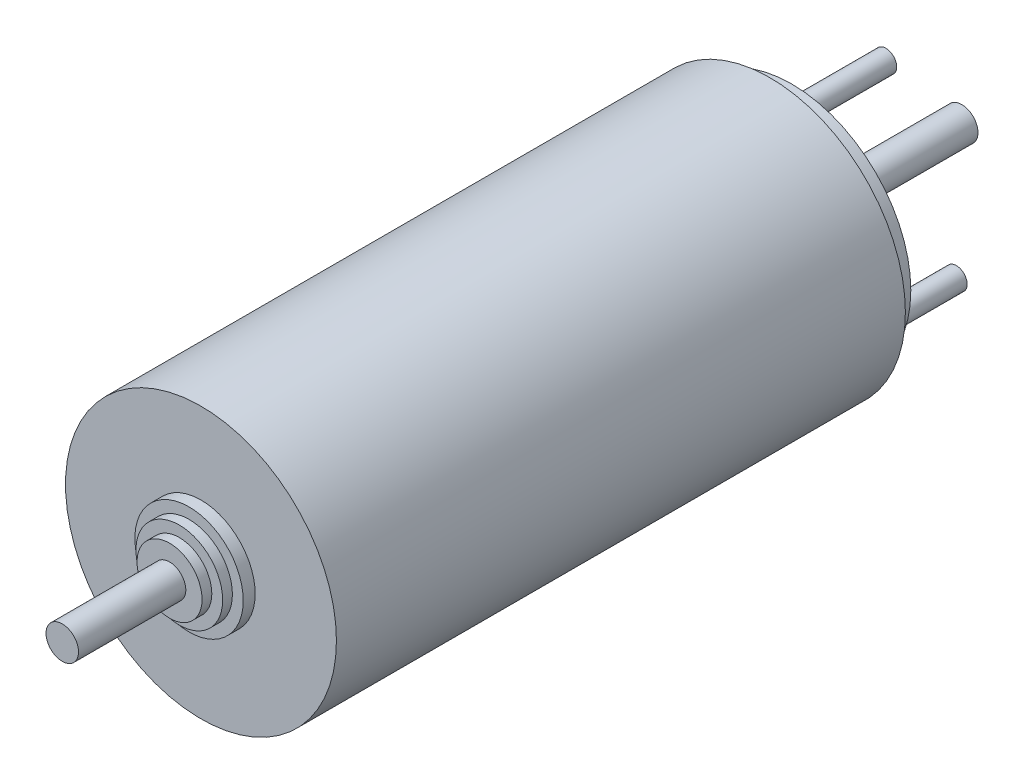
SolidWorks part; units mm, degrees
ref_plane "Front Plane" through (0, 0, 0) normal (0, 0, 1) x (1, 0, 0)
ref_plane "Top Plane" through (0, 0, 0) normal (0, 1, 0) x (1, 0, 0)
ref_plane "Right Plane" through (0, 0, 0) normal (1, 0, 0) x (0, 0, -1)
sketch "Sketch1" plane through (0, 0, 0) normal (0, 0, 1) x (1, 0, 0)
  circle A0 centre (-5.3704, 6.8973) radius 12.5
  dimension "D1" = 25
extrude "Boss-Extrude1" add sketch "Sketch1" along normal blind 52.5
sketch "Sketch2" plane through (0, 0, 52.5) normal (0, 0, 1) x (1, 0, 0)
  circle A0 centre (-5.3704, 6.8973) radius 5
  dimension "D1" = 10
extrude "Boss-Extrude2" add sketch "Sketch2" along normal blind 1.1
sketch "Sketch3" plane through (0, 0, 53.6) normal (0, 0, 1) x (1, 0, 0)
  circle A0 centre (-5.3704, 6.8973) radius 4
  dimension "D1" = 8
extrude "Boss-Extrude3" add sketch "Sketch3" along normal blind 0.9
sketch "Sketch4" plane through (0, 0, 54.5) normal (0, 0, 1) x (1, 0, 0)
  circle A0 centre (-5.3704, 6.8973) radius 3
  dimension "D1" = 6
extrude "Boss-Extrude4" add sketch "Sketch4" along normal blind 0.9
sketch "Sketch5" plane through (0, 0, 55.4) normal (0, 0, 1) x (1, 0, 0)
  circle A0 centre (-5.3704, 6.8973) radius 1.5
  dimension "D1" = 3
extrude "Boss-Extrude5" add sketch "Sketch5" along normal blind 9.9
sketch "Sketch6" plane through (0, 0, 0) normal (0, 0, -1) x (-1, 0, 0)
  circle A0 centre (5.3704, 6.8973) radius 11
  dimension "D1" = 22
extrude "Boss-Extrude6" add sketch "Sketch6" along normal blind 2
sketch "Sketch7" plane through (0, 0, -2) normal (0, 0, -1) x (-1, 0, 0)
  circle A0 centre (5.3704, 6.8973) radius 4
  dimension "D1" = 8
extrude "Boss-Extrude7" add sketch "Sketch7" along normal blind 1.35
sketch "Sketch8" plane through (0, 0, -3.35) normal (0, 0, -1) x (-1, 0, 0)
  circle A0 centre (5.3704, 6.8973) radius 3
  dimension "D1" = 6
extrude "Boss-Extrude8" add sketch "Sketch8" along normal blind 1.35
sketch "Sketch9" plane through (0, 0, -4.7) normal (0, 0, -1) x (-1, 0, 0)
  circle A0 centre (5.3704, 6.8973) radius 1.5
  dimension "D1" = 3
extrude "Boss-Extrude9" add sketch "Sketch9" along normal blind 13
sketch "Sketch10" plane through (0, 0, -2) normal (0, 0, -1) x (-1, 0, 0)
  circle A0 centre (5.3706, 15.3973) radius 1
  circle A1 centre (5.3704, 6.8973) radius 1.5 construction
  circle A3 centre (11.8706, 1.2808) radius 1
  circle A4 centre (-1.1294, 1.2808) radius 1
  dimension "D2" = 2
  dimension "D4" = 2
  dimension "D5" = 2
  dimension "D1" = 8.5
extrude "Boss-Extrude10" add sketch "Sketch10" along normal blind 8.7
